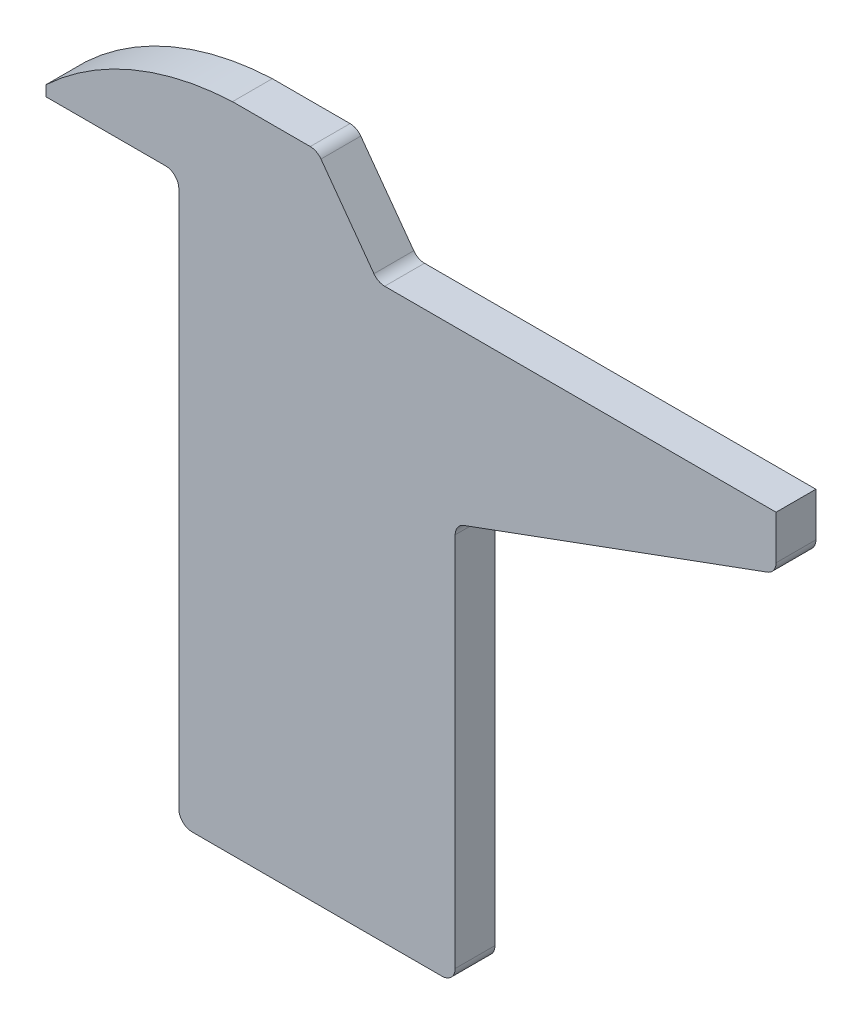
SolidWorks part; units mm, degrees
ref_plane "Plan de face" through (0, 0, 0) normal (0, 0, 1) x (1, 0, 0)
ref_plane "Plan de dessus" through (0, 0, 0) normal (0, 1, 0) x (1, 0, 0)
ref_plane "Plan de droite" through (0, 0, 0) normal (1, 0, 0) x (0, 0, -1)
sketch "Esquisse1" plane through (0, 0, 0) normal (0, 0, -1) x (-1, 0, 0)
  line L0 (-5.4112, 15) -> (-5.4112, -21.533) construction
  line L2 (-15.8224, -13.3635) -> (-15.8224, -41.6651)
  line L3 (-14.8224, -42.6651) -> (4, -42.6651)
  line L4 (5, -1.2) -> (5, -41.6651)
  line L5 (-9.8224, 15) -> (-1, 15) construction
  line L6 (0, -174) -> (0, -179) construction
  line L7 (-40, 0.2) -> (-40, -3.1016)
  line L8 (-40, 0) -> (-40, 3.3016) construction
  line L9 (-39.3443, -4.0404) -> (-16.4782, -12.4247)
  line L11 (15, -0.2) -> (15, 0.6)
  line L12 (15, 0) -> (15, -1) construction
  line L13 (1, 0) -> (15, 0) construction
  line L14 (-40, 0.2) -> (-10.5093, 0.2)
  line L15 (15, -0.2) -> (13.8898, -0.2) construction
  line L17 (-4.9019, 6.5108) -> (0.9564, 6.5108)
  line L18 (15, -0.2) -> (6, -0.2)
  line L19 (-9.7005, 0.6119) -> (-5.7107, 6.0989)
  line L21 (-40, 0.1) -> (-37.099, 0.1) construction
  line L22 (-39.3443, 4.2404) -> (-10.1667, 14.9389) construction
  arc A0 (0.9564, -6.9108) -> (15, -1) centre (0, 15) ccw construction
  arc A2 (-10.5093, 0.2) -> (-9.7005, 0.6119) centre (-10.5093, 1.2) ccw
  arc A3 (-4.9019, 6.5108) -> (-5.7107, 6.0989) centre (-4.9019, 5.5108) ccw
  arc A5 (0.9564, -6.9108) -> (15, -1) centre (0, 15) ccw construction
  arc A6 (0.9564, 6.5108) -> (15, 0.6) centre (0, -15.4) cw
  arc A7 (4, -42.6651) -> (5, -41.6651) centre (4, -41.6651) ccw
  arc A8 (-15.8224, -41.6651) -> (-14.8224, -42.6651) centre (-14.8224, -41.6651) ccw
  arc A11 (6, -0.2) -> (5, -1.2) centre (6, -1.2) ccw
  arc A12 (-16.4782, -12.4247) -> (-15.8224, -13.3635) centre (-16.8224, -13.3635) cw
  arc A13 (-40, -3.1016) -> (-39.3443, -4.0404) centre (-39, -3.1016) ccw
  point P12 (-5.4112, 6.5108)
  point P32 (-5.4112, 6.3681)
  point P33 (-9.9417, 0.1)
  point P36 (-15.8224, -42.6651)
  point P43 (-10, 0.2)
  point P46 (-5.4112, 6.5108)
  point P51 (-15.8224, -12.6651)
  point P55 (-10, 0)
  point P58 (-5.4112, 6.5108)
  dimension "D5" = 1
  dimension "D6" = 1
  dimension "D7" = 1
  dimension "D1" = 5
  dimension "D2" = 30
  dimension "D3" = 0.2
  dimension "D4" = 0.2
extrude "Boss.-Extru.1" add sketch "Esquisse1" along normal blind 3
